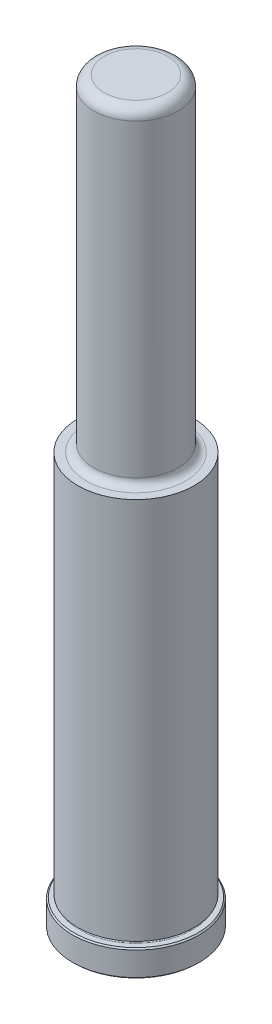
SolidWorks part; units mm, degrees
ref_plane "Front Plane" through (0, 0, 0) normal (0, 0, 1) x (1, 0, 0)
ref_plane "Top Plane" through (0, 0, 0) normal (0, 1, 0) x (1, 0, 0)
ref_plane "Right Plane" through (0, 0, 0) normal (1, 0, 0) x (0, 0, -1)
sketch "Sketch1" plane through (0, 0, 0) normal (1, 0, 0) x (0, 0, -1)
  line L0 (0, 0) -> (19.05, 0)
  line L1 (19.05, 0) -> (19.05, 7.9248)
  line L2 (19.05, 7.9248) -> (17.0688, 7.9248)
  line L3 (16.6878, 2.6782) -> (16.6878, 5.9795) construction
  line L4 (17.0688, 8.6868) -> (17.4752, 8.6868)
  line L5 (17.4752, 8.6868) -> (17.4752, 123.825)
  line L6 (17.4752, 123.825) -> (14.9733, 123.825)
  line L7 (12.6873, 126.111) -> (12.6873, 222.25)
  line L9 (12.6873, 222.25) -> (0, 222.25)
  line L10 (0, 222.25) -> (0, 0)
  line L11 (0, 0) -> (0, -7.2694) construction
  arc A0 (17.0688, 8.6868) -> (17.0688, 7.9248) centre (17.0688, 8.3058) ccw
  arc A1 (14.9733, 123.825) -> (12.6873, 126.111) centre (14.9733, 126.111) cw
  point P19 (12.6873, 123.825)
  dimension "D14" = 0.762
  dimension "D8" = 2.286
  dimension "T" = 7.9248
  dimension "D2" = 0.762
  dimension "M" = 38.1
  dimension "B" = 34.9504
  dimension "L" = 222.25
  dimension "D7" = 0.7874
  dimension "A" = 123.825
  dimension "D" = 25.3746
  dimension "D15" = 98.425
revolve "Revolve1" add sketch "Sketch1" angle 360 about L11
chamfer "Chamfer1" distance 0.381 angle 45 2 edges at (0, 0, 19.05) (0, 7.9248, 19.05)
fillet "Fillet7" radius 3.175 1 edges at (0, 222.25, 12.6873)
